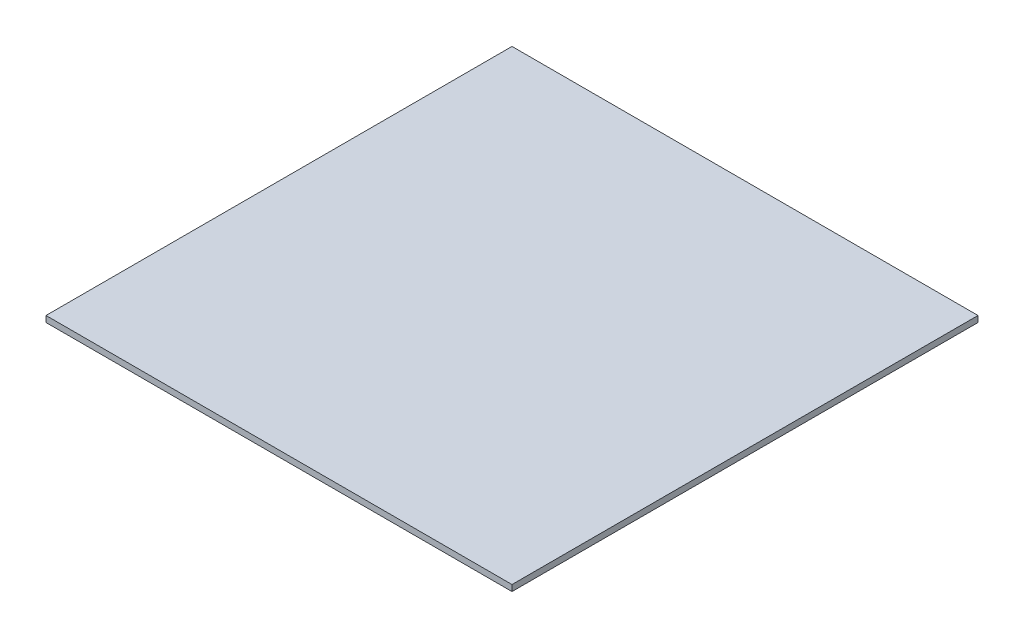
SolidWorks part; units mm, degrees
ref_plane "Front Plane" through (0, 0, 0) normal (0, 0, 1) x (1, 0, 0)
ref_plane "Top Plane" through (0, 0, 0) normal (0, 1, 0) x (1, 0, 0)
ref_plane "Right Plane" through (0, 0, 0) normal (1, 0, 0) x (0, 0, -1)
sketch "Sketch1" plane through (0, 0, 0) normal (0, 1, 0) x (1, 0, 0)
  line L1 (-152.4, -152.4) -> (152.4, -152.4)
  line L2 (-152.4, -152.4) -> (-152.4, 152.4)
  line L3 (-152.4, 152.4) -> (152.4, 152.4)
  line L4 (152.4, -152.4) -> (152.4, 152.4)
  line L5 (-152.4, -152.4) -> (152.4, 152.4) construction
  line L6 (-152.4, 152.4) -> (152.4, -152.4) construction
  point P0 (0, 0)
  dimension "D1" = 304.8
  dimension "D2" = 304.8
extrude "Boss-Extrude1" add sketch "Sketch1" along normal blind 4
